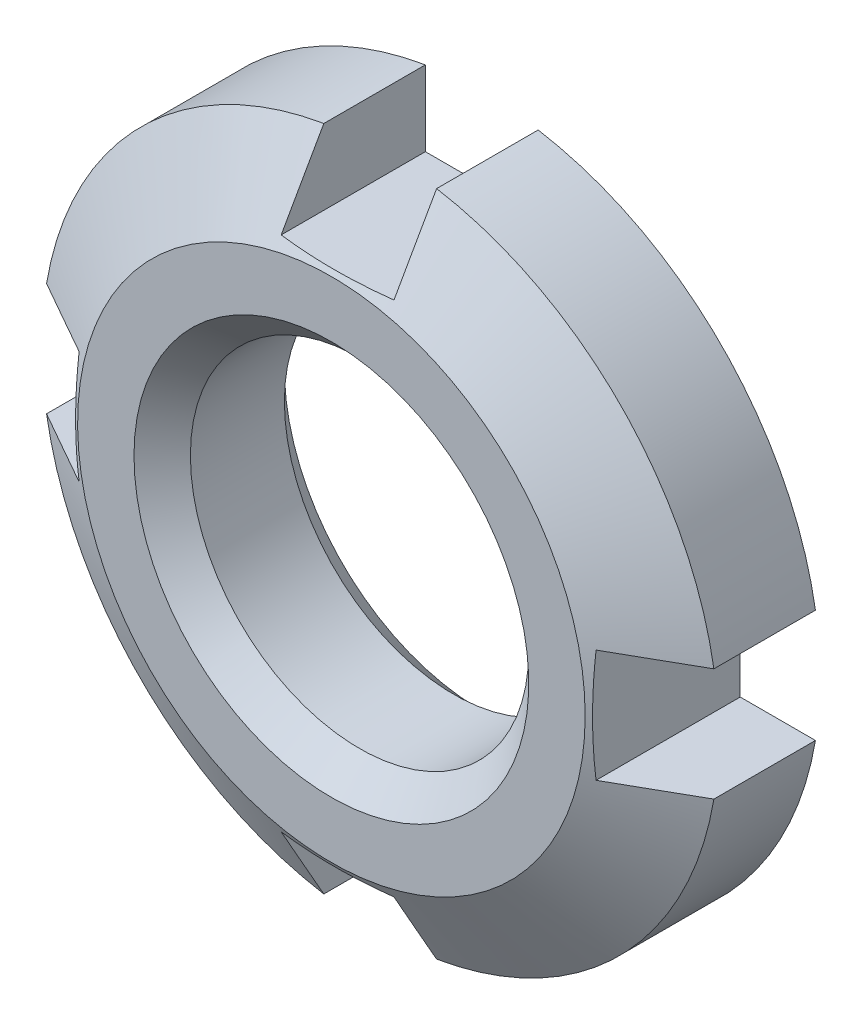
SolidWorks part; units mm, degrees
ref_plane "Front Plane" through (0, 0, 0) normal (0, 0, 1) x (1, 0, 0)
ref_plane "Top Plane" through (0, 0, 0) normal (0, 1, 0) x (1, 0, 0)
ref_plane "Right Plane" through (0, 0, 0) normal (1, 0, 0) x (0, 0, -1)
sketch "BaseNutSke" plane through (0, 0, 0) normal (0, 1, 0) x (1, 0, 0)
  line L0 (0, 0) -> (0, 9.527) construction
  line L1 (-6.75, -4) -> (0, -4)
  line L2 (-9, -2.701) -> (-9, 0)
  line L3 (-9, 0) -> (0, 0)
  line L4 (0, -4) -> (0, 0)
  line L5 (-6.75, -4) -> (-9, -2.701)
  dimension "Base_diameter" = 18
  dimension "Top_diameter" = 13.5
  dimension "Top_chamfer" = 30
  dimension "Thickness" = 4
revolve "BaseNut" add sketch "BaseNutSke" angle 360 about L0
sketch "SlotSke" plane through (0, 0, 0) normal (0, 0, 1) x (1, 0, 0)
  line L0 (0, 0) -> (0, 19.9956) construction
  line L1 (-1.5, 9.8741) -> (1.5, 9.8741)
  line L2 (-1.5, 9.8741) -> (-1.5, 6.8741)
  line L3 (-1.5, 6.8741) -> (1.5, 6.8741)
  line L4 (1.5, 9.8741) -> (1.5, 6.8741)
  circle A0 centre (0, 0) radius 9 construction
  circle A1 centre (0, 0) radius 9 construction
  point P9 (1.5, 8.8741)
  dimension "Slot_width" = 3
  dimension "Slot_depth" = 2
extrude "CutSlot" cut sketch "SlotSke" along normal through all
pattern_circular "SlotPat" count 4 over 360 about axis through (0, 0, 0) along (0, 0, 1) of "CutSlot"
sketch "HoleSke" plane through (0, 0, 0) normal (0, 0, 1) x (1, 0, 0)
  circle A0 centre (0, 0) radius 4.5
  dimension "Tap_drill" = 9
extrude "TappedHole" cut sketch "HoleSke" along normal through all
chamfer "Chamfer1" distance 0.75 angle 45 2 edges at (4.5, 0, 0) (4.5, 0, 4)
sketch "ThdSchSke" plane through (0, 0, 0) normal (0, 1, 0) x (1, 0, 0)
  line L0 (-5, -2.9613) -> (-4.5, -3.25)
  line L1 (-4.5, -3.25) -> (-3.9226, -3.25)
  line L2 (-3.9226, -3.25) -> (-3.9226, -2.6726)
  line L3 (-3.9226, -2.6726) -> (-4.5, -2.6726)
  line L4 (-4.5, -2.6726) -> (-5, -2.9613)
  line L5 (0, 0) -> (0, -27.9917) construction
  line L6 (-4.5, -3.25) -> (4.5, -3.25) construction
  dimension "D1" = 9
  dimension "D2" = 10
revolve "ThreadSchematic" [suppressed] cut sketch "ThdSchSke" angle 360 about L5
pattern_linear "ThdSchPat" [suppressed] count 4 along (0, 0, -1)
equation "\"D1@ThdSchSke\" = \"Tap_drill@HoleSke\""
equation "\"D2@ThdSchSke\" = \"Thread_major@ThreadCosmetic\""
equation "\"ADVANCE@ThdSchPat\" = \"ADVANCE@Chamfer1\""
equation "\"D1@ThdSchPat\" =  int(  ( \"Thickness@BaseNutSke\"  - 2 *  \"ADVANCE@Chamfer1\" ) / \"ADVANCE@Chamfer1\" )  + 1"
